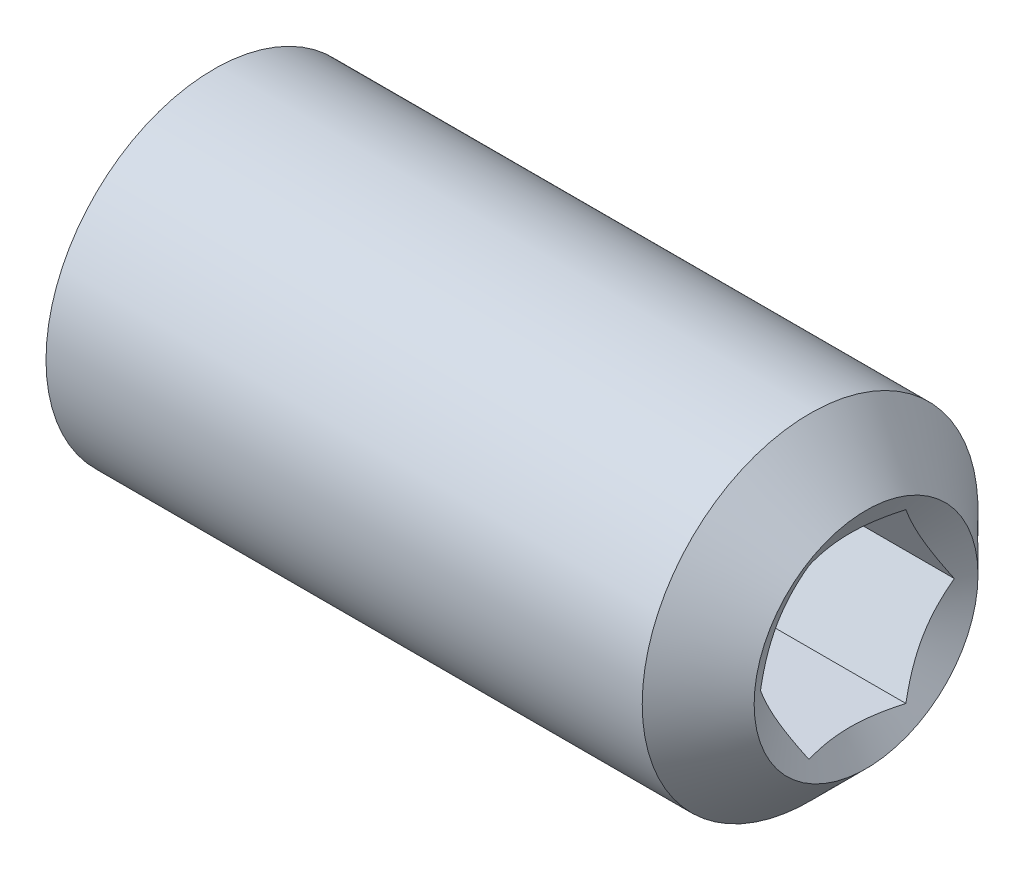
SolidWorks part; units mm, degrees
ref_plane "Plane1" through (0, 0, 0) normal (0, 0, 1) x (1, 0, 0)
ref_plane "Plane2" through (0, 0, 0) normal (0, 1, 0) x (1, 0, 0)
ref_plane "Plane3" through (0, 0, 0) normal (1, 0, 0) x (0, 0, -1)
sketch "BodySke" plane through (0, 0, 0) normal (0, 0, 1) x (1, 0, 0)
  line L0 (0, 0) -> (0, 2.4)
  line L1 (0, 2.4) -> (0.3464, 3)
  line L2 (0.3464, 3) -> (11, 3)
  line L3 (11, 3) -> (12, 2)
  line L4 (10.8453, 0) -> (0, 0)
  line L5 (-12.7, 0) -> (88.9, 0) construction
  line L6 (10.8453, 0) -> (12, 2)
  line L7 (12, 2) -> (12, 11.525) construction
  line L8 (0, -2.4) -> (0.3464, -3) construction
  line L9 (10.8453, 0) -> (12, -2) construction
  line L10 (11, -3) -> (12, -2) construction
  line L11 (0.875, 15.875) -> (0.875, -3.175) construction
  dimension "Length" = 12
  dimension "Diameter" = 6
  dimension "Drive_ch_ang" = 60
  dimension "Minor_dia" = 4.8
  dimension "Cup_nose_ang" = 45
  dimension "Cup_ang" = 120
  dimension "Cup_dia" = 4
  dimension "Advance" = 1.75
revolve "BaseBody" add sketch "BodySke" angle 360 about L5
sketch "Sketch2" plane through (0, 0, 0) normal (-1, 0, 0) x (0, 0, 1)
  line L0 (0.866, 1.5) -> (-0.866, 1.5)
  line L1 (-0.866, 1.5) -> (-1.7321, 0)
  line L2 (0.866, 1.5) -> (1.7321, 0)
  line L3 (0.866, -1.5) -> (1.7321, 0)
  line L4 (0.866, -1.5) -> (-0.866, -1.5)
  line L5 (-0.866, -1.5) -> (-1.7321, 0)
  dimension "Hex_size" = 3
  dimension "D2" = 1.5
  dimension "D3" = 1.5
extrude "Hex" cut sketch "Sketch2" against normal through all
sketch "ThdSchSke" plane through (0, 0, 0) normal (0, 0, 1) x (1, 0, 0)
  line L0 (0.3464, -2.4) -> (-0.0737, -3)
  line L1 (0.3464, -2.4) -> (0.7665, -3)
  line L2 (0.7665, -3) -> (0.7665, -3.75)
  line L3 (-3.175, 0) -> (5.1513, 0) construction
  line L4 (0.3464, 3) -> (0.3464, -3) construction
  line L5 (0.7665, -3.75) -> (-0.0737, -3.75)
  line L6 (-0.0737, -3.75) -> (-0.0737, -3)
  dimension "Thread_minor" = 4.8
  dimension "Diameter" = 6
  dimension "SideAngle" = 55
  dimension "VeeAngle" = 70
  dimension "Overcut" = 7.5
revolve "ThreadSchematic" [suppressed] cut sketch "ThdSchSke" angle 360 about L3
pattern_linear "ThdSchPat" [suppressed]
equation "\"D2@Sketch2\" = \"Hex_size@Sketch2\" / 2"
equation "\"D3@Sketch2\" = \"Hex_size@Sketch2\" / 2"
equation "\"Thread_minor@ThreadCosmetic\" = \"Minor_dia@BodySke\""
equation "\"Thread_minor@ThdSchSke\" = \"Thread_minor@ThreadCosmetic\""
equation "\"Diameter@ThdSchSke\" = \"Diameter@BodySke\""
equation "\"Overcut@ThdSchSke\" = \"Diameter@BodySke\" * 1.25"
equation "\"Num_threads@ThdSchPat\" = int( (\"Length@BodySke\" - ( ( ( \"Diameter@BodySke\" - \"Minor_dia@BodySke\" ) * 0.5 ) / tan( \"Drive_ch_ang@BodySke\" * 0.017453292 ) ) - ( ( ( \"Diameter@BodySke\" - \"Cup_dia@BodySk"
equation "\"Advance@ThdSchPat\" = (\"Length@BodySke\" - ( ( ( \"Diameter@BodySke\" - \"Minor_dia@BodySke\" ) * 0.5 ) / tan( \"Drive_ch_ang@BodySke\" * 0.017453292 ) ) - ( ( ( \"Diameter@BodySke\" - \"Cup_dia@BodySke\" ) * 0."
equation "' \"Num_threads@ThdSchPat\" = \"Num_threads@ThdSchPat\" - sgn( \"Num_threads@ThdSchPat\" - 1) '---chamfered tips only---"
